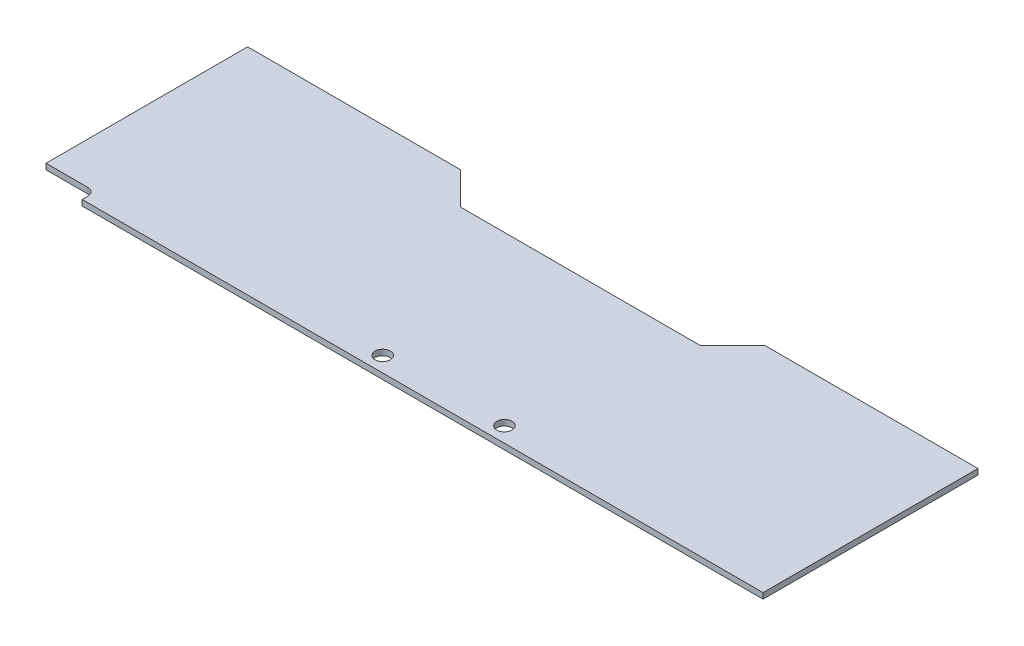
SolidWorks part; units mm, degrees
ref_plane "Front Plane" through (0, 0, 0) normal (0, 0, 1) x (1, 0, 0)
ref_plane "Top Plane" through (0, 0, 0) normal (0, 1, 0) x (1, 0, 0)
ref_plane "Right Plane" through (0, 0, 0) normal (1, 0, 0) x (0, 0, -1)
sketch "Sketch1" plane through (0, 0, 0) normal (0, 1, 0) x (1, 0, 0)
  line L0 (-1219.2, 358.775) -> (-508, 358.775)
  line L1 (-1219.2, 358.775) -> (1219.2, 358.775) construction
  line L2 (-1219.2, 358.775) -> (-1219.2, -314.325) construction
  line L3 (-1054.1, -358.775) -> (1219.2, -358.775) construction
  line L4 (1219.2, 358.775) -> (1219.2, -358.775) construction
  line L5 (-1219.2, 358.775) -> (1219.2, -358.775) construction
  line L6 (-1219.2, -358.775) -> (1219.2, 358.775) construction
  line L7 (-508, 358.775) -> (-400.05, 250.825)
  line L8 (-400.05, 250.825) -> (400.05, 250.825)
  line L9 (400.05, 250.825) -> (508, 358.775)
  line L10 (508, 358.775) -> (1219.2, 358.775)
  line L11 (1219.2, 358.775) -> (1219.2, -358.775)
  line L12 (1219.2, -358.775) -> (-1054.1, -358.775)
  line L13 (-1219.2, -314.325) -> (-1219.2, 358.775)
  line L14 (0, 250.825) -> (0, 403.225) construction
  line L15 (-1219.2, -314.325) -> (-1219.2, -358.775) construction
  line L18 (-1219.2, -314.325) -> (-1079.5, -314.325)
  line L19 (-1054.1, -358.775) -> (-1054.1, -339.725)
  line L20 (-1219.2, -358.775) -> (-1054.1, -314.325) construction
  line L21 (-1219.2, -314.325) -> (-1054.1, -358.775) construction
  line L22 (-1219.2, -358.775) -> (-1054.1, -358.775) construction
  arc A0 (-1054.1, -339.725) -> (-1079.5, -314.325) centre (-1079.5, -339.725) ccw
  point P0 (0, 0)
  point P15 (-1136.65, -336.55)
  dimension "D9" = 25.4
  dimension "D1" = 2438.4
  dimension "D2" = 717.55
  dimension "D3" = 711.2
  dimension "D4" = 609.6
  dimension "D5" = 711.2
  dimension "D6" = 45
  dimension "D7" = 165.1
  dimension "D8" = 44.45
extrude "Boss-Extrude1" add sketch "Sketch1" along normal blind 19.05
sketch "Sketch4" plane through (0, 19.05, 0) normal (0, 1, 0) x (1, 0, 0)
  line L5 (-1054.1, -358.775) -> (1219.2, -358.775) construction
  line L6 (-1219.2, 358.775) -> (-1219.2, -314.325) construction
  line L8 (381, -358.775) -> (-177.8, -358.775) construction
  line L9 (381, -358.775) -> (381, -249.034) construction
  line L10 (381, -249.034) -> (-177.8, -249.034) construction
  line L11 (-177.8, -358.775) -> (-177.8, -249.034) construction
  line L12 (381, -358.775) -> (-177.8, -249.034) construction
  line L13 (381, -249.034) -> (-177.8, -358.775) construction
  circle A2 centre (-101.6, -307.975) radius 25.4
  circle A3 centre (304.8, -307.975) radius 25.4
  point P10 (101.6, -303.9045)
  point P13 (147.0222, -307.975)
  point P14 (338.4134, -307.975)
  dimension "D4" = 1041.4
  dimension "D1" = 50.8
  dimension "D2" = 50.8
  dimension "D3" = 1600.2
  dimension "D5" = 76.2
  dimension "D6" = 76.2
extrude "Cut-Extrude1" cut sketch "Sketch4" against normal through all
sketch "Sketch5" plane through (0, 19.05, 0) normal (0, 1, 0) x (1, 0, 0)
  line L0 (-1219.2, 358.775) -> (-508, 358.775)
  line L1 (-508, 358.775) -> (-400.05, 250.825)
  line L2 (-400.05, 250.825) -> (400.05, 250.825)
  line L3 (400.05, 250.825) -> (508, 358.775)
  line L4 (508, 358.775) -> (1219.2, 358.775)
